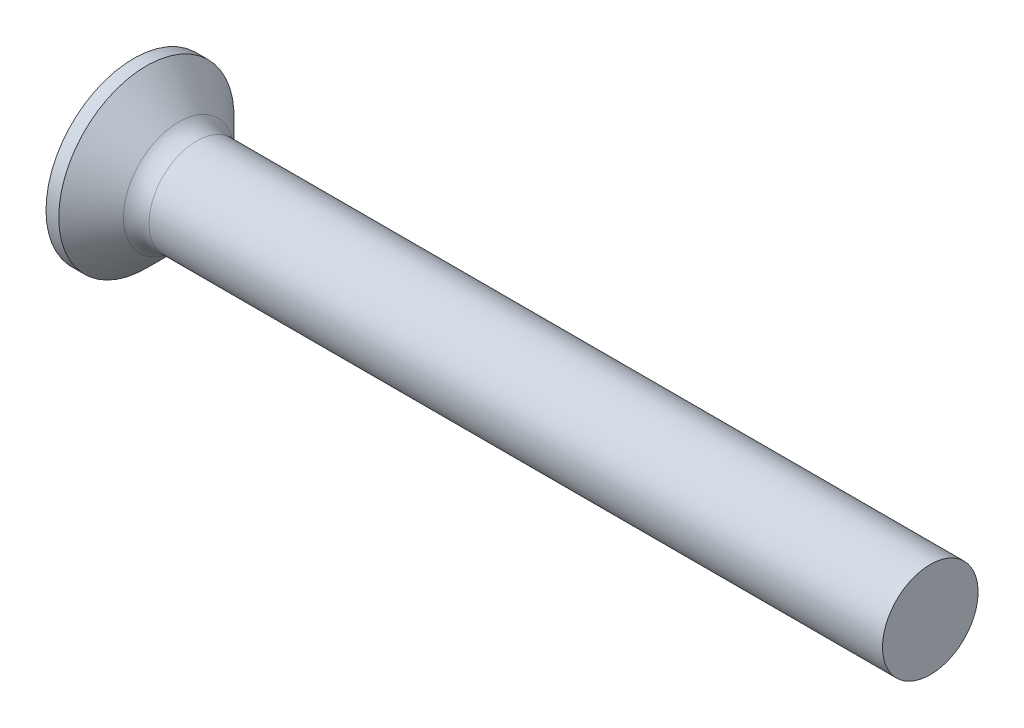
SolidWorks part; units mm, degrees
ref_plane "Plane1" through (0, 0, 0) normal (0, 0, 1) x (1, 0, 0)
ref_plane "Plane2" through (0, 0, 0) normal (0, 1, 0) x (1, 0, 0)
ref_plane "Plane3" through (0, 0, 0) normal (1, 0, 0) x (0, 0, -1)
sketch "BodySke" plane through (0, 0, 0) normal (0, 0, 1) x (1, 0, 0)
  line L0 (0, 0) -> (0, 2.75)
  line L1 (0, 2.75) -> (0.4, 2.75)
  line L2 (1.65, 1.5) -> (25, 1.5)
  line L3 (25, 1.5) -> (25, 0)
  line L4 (25, 0) -> (0, 0)
  line L5 (-6.35, 0) -> (82.55, 0) construction
  line L6 (1.65, -1.5) -> (25, -1.5) construction
  line L7 (0.4, -2.75) -> (1.65, -1.5) construction
  line L8 (0.4, 2.75) -> (1.65, 1.5)
  line L9 (0, -2.75) -> (0.4, -2.75) construction
  line L10 (2.15, 3.0875) -> (2.15, -6.4375) construction
  line L11 (0, 6.35) -> (0, -3.175) construction
  dimension "Diameter" = 3
  dimension "Length" = 25
  dimension "Head_ht" = 1.65
  dimension "Head_dia" = 5.5
  dimension "Head_ang" = 90
  dimension "D6" = 0.4
  dimension "Advance" = 0.5
  dimension "Thread_nom" = 25
revolve "Base-Revolve" add sketch "BodySke"
fillet "Fillet1" radius 0.8 1 edges at (1.65, 0, 1.5)
sketch "Sketch3" plane through (0, 0, 0) normal (-1, 0, 0) x (0, 0, 1)
  line L0 (-0.37, 1.5) -> (0.37, 1.5)
  line L1 (0.37, 1.5) -> (0.37, -1.5)
  line L2 (0.37, -1.5) -> (-0.37, -1.5)
  line L3 (-0.37, -1.5) -> (-0.37, 1.5)
  dimension "D1" = 1.5
  dimension "Cross_dia" = 3
  dimension "D2" = 0.37
  dimension "Cross_width" = 0.74
ref_plane "Plane4" through (2.01, 0, 0) normal (-1, 0, 0) x (0, 0, 1)
sketch "Sketch4" plane through (2.01, 0, 0) normal (-1, 0, 0) x (0, 0, 1)
  line L0 (-0.37, 0.4979) -> (0.37, 0.4979)
  line L3 (0.37, 0.4979) -> (0.37, -0.4979)
  line L4 (0.37, -0.4979) -> (-0.37, -0.4979)
  line L5 (-0.37, -0.4979) -> (-0.37, 0.4979)
  dimension "D1" = 0.74
  dimension "D2" = 0.9957
  dimension "D3" = 0.37
  dimension "D4" = 0.4979
loft "Recess" cut profiles "Sketch3", "Sketch4"
pattern_circular "RecPat" count 2 every 90 about axis through (0, 0, 0) along (1, 0, 0) of "Recess"
sketch "RecCorSke" plane through (0, 0, 0) normal (0, 0, 1) x (1, 0, 0)
  line L0 (-3.175, 0) -> (15.875, 0) construction
  line L2 (0, 0) -> (0, 0.6966)
  line L3 (0, 0.6966) -> (2.01, 0.556)
  line L4 (2.01, 0.556) -> (2.1907, 0)
  line L5 (2.1907, 0) -> (0, 0)
  dimension "Diameter" = 1.112
  dimension "Depth" = 2.01
  dimension "Draft_angle" = 4
  dimension "Bottom_angle" = 18
revolve "RecessCore" cut sketch "RecCorSke" angle 360 about L0
sketch "ThdSchSke" plane through (0, 0, 0) normal (0, 0, 1) x (1, 0, 0)
  line L0 (2.15, -1.2195) -> (1.9536, -1.5)
  line L1 (2.15, -1.2195) -> (2.3464, -1.5)
  line L2 (2.3464, -1.5) -> (2.3464, -1.875)
  line L3 (-3.175, 0) -> (5.1513, 0) construction
  line L5 (2.3464, -1.875) -> (1.9536, -1.875)
  line L6 (1.9536, -1.875) -> (1.9536, -1.5)
  line L7 (0, 2.75) -> (0, -2.75) construction
  dimension "Thread_minor" = 2.439
  dimension "Diameter" = 3
  dimension "Start" = 2.15
  dimension "SideAngle" = 55
  dimension "VeeAngle" = 70
  dimension "Overcut" = 3.75
revolve "ThreadSchematic" [suppressed] cut sketch "ThdSchSke" angle 360 about L3
pattern_linear "ThdSchPat" [suppressed]
equation "\"D1@Sketch3\" = \"Cross_dia@Sketch3\" / 2"
equation "\"D2@Sketch3\" = \"Cross_width@Sketch3\" / 2"
equation "\"Depth@RecCorSke\" = \"Cross_depth@Plane4\""
equation "\"D1@Sketch4\" = \"Cross_width@Sketch3\""
equation "\"D2@Sketch4\" = \"Cross_dia@Sketch3\" - 2.0 * \"Cross_depth@Plane4\" * tan(26.5  * 0.017453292)"
equation "\"D3@Sketch4\" = \"D1@Sketch4\" / 2"
equation "\"D4@Sketch4\" = \"D2@Sketch4\" / 2"
equation "\"Thread_length@ThreadCosmetic\" = ((sgn( (\"Length@BodySke\" - \"Advance@BodySke\" * 1.0 - \"Head_ht@BodySke\" ) - \"Thread_nom@BodySke\" )-1)*( (\"Length@BodySke\" - \"Advance@BodySke\" * 1.0 - \"Head_ht@BodySke\" "
equation "\"Thread_minor@ThdSchSke\" = \"Thread_minor@ThreadCosmetic\""
equation "\"Diameter@ThdSchSke\" = \"Diameter@BodySke\""
equation "\"Overcut@ThdSchSke\" = \"Diameter@BodySke\" * 1.25"
equation "\"Start@ThdSchSke\" = 0.000001 + \"Length@BodySke\" - \"Thread_length@ThreadCosmetic\"  '---Countersunk---"
equation "\"Num_threads@ThdSchPat\" = int( \"Thread_length@ThreadCosmetic\" / \"Advance@BodySke\" + 0.999 )  + 1"
equation "\"Advance@ThdSchPat\" = \"Thread_length@ThreadCosmetic\" /  (\"Num_threads@ThdSchPat\" - 1) 'relax it"
